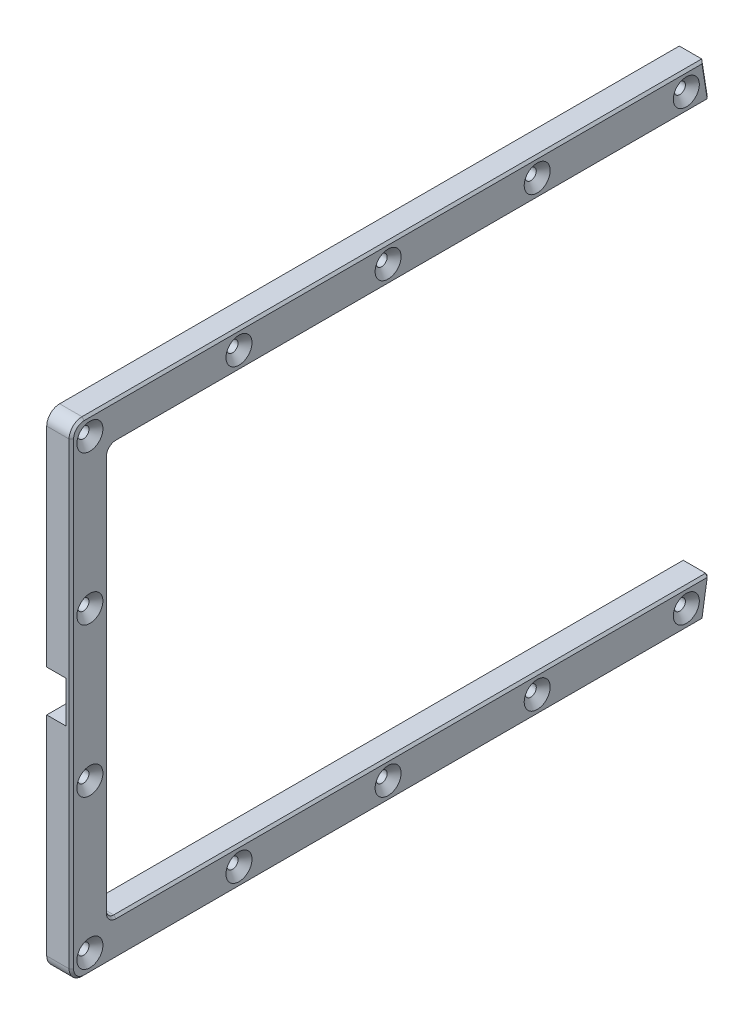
SolidWorks part; units mm, degrees
ref_plane "Front Plane" through (0, 0, 0) normal (0, 0, 1) x (1, 0, 0)
ref_plane "Top Plane" through (0, 0, 0) normal (0, 1, 0) x (1, 0, 0)
ref_plane "Right Plane" through (0, 0, 0) normal (1, 0, 0) x (0, 0, -1)
sketch "Sketch1" plane through (0, 0, 0) normal (1, 0, 0) x (0, 0, -1)
  line L0 (-5.4557, 104.0696) -> (-5.4557, -52.242)
  line L1 (-1.0615, -56.6362) -> (210.0633, -56.6362)
  line L2 (210.0633, -56.6362) -> (212.0757, -43.9362)
  line L3 (212.0757, -43.9362) -> (7.2189, -43.9362)
  line L4 (7.2189, -43.9362) -> (7.2189, 95.7638)
  line L5 (210.0633, 108.4638) -> (-1.0615, 108.4638)
  line L6 (0.8689, 0.5138) -> (7.2189, 0.5138) construction
  line L7 (210.0633, -56.6362) -> (223.1443, 25.9138) construction
  line L8 (210.0633, 108.4638) -> (-1.0615, 108.4638) construction
  line L9 (-1.0615, -56.6362) -> (210.0633, -56.6362) construction
  line L10 (7.2189, 95.7638) -> (212.0757, 95.7638)
  line L11 (7.2189, 95.7638) -> (7.2189, 108.4638) construction
  line L12 (212.0757, 95.7638) -> (210.0633, 108.4638)
  line L13 (223.1443, 25.9138) -> (210.0633, 108.4638) construction
  line L14 (102.4689, -50.2862) -> (102.4689, -43.9362) construction
  line L15 (51.6689, -43.9362) -> (51.6689, -56.6362) construction
  circle A0 centre (102.4689, -50.2862) radius 1.8923
  arc A1 (-5.4557, -52.242) -> (-1.0615, -56.6362) centre (-1.0615, -52.242) ccw construction
  circle A2 centre (0.8689, 51.3138) radius 1.8923 construction
  arc A3 (-5.4557, 104.0696) -> (-1.0615, 108.4638) centre (-1.0615, 104.0696) cw
  arc A4 (-1.0615, 108.4638) -> (-5.4557, 104.0696) centre (-1.0615, 104.0696) ccw construction
  circle A5 centre (204.0689, -50.2862) radius 1.8923 construction
  arc A6 (-5.4557, -52.242) -> (-1.0615, -56.6362) centre (-1.0615, -52.242) ccw
  circle A7 centre (153.2689, -50.2862) radius 1.8923 construction
  circle A8 centre (102.4689, -50.2862) radius 1.8923 construction
  circle A9 centre (153.2689, -50.2862) radius 1.8923
  circle A10 centre (51.6689, -50.2862) radius 1.8923
  circle A11 centre (0.8689, -50.2862) radius 1.8923
  circle A12 centre (0.8689, 0.5138) radius 1.8923
  circle A13 centre (0.8689, 51.3138) radius 1.8923
  circle A14 centre (204.0689, -50.2862) radius 1.8923
  circle A15 centre (51.6689, -50.2862) radius 1.8923 construction
  circle A16 centre (0.8689, -50.2862) radius 1.8923 construction
  circle A17 centre (0.8689, 0.5138) radius 1.8923 construction
  circle A18 centre (0.8689, 102.1138) radius 1.8923
  circle A19 centre (51.6689, 102.1138) radius 1.8923
  circle A20 centre (102.4689, 102.1138) radius 1.8923
  circle A21 centre (153.2689, 102.1138) radius 1.8923
  circle A22 centre (204.0689, 102.1138) radius 1.8923
  circle A23 centre (0.8689, 102.1138) radius 1.8923 construction
  circle A24 centre (51.6689, 102.1138) radius 1.8923 construction
  circle A25 centre (102.4689, 102.1138) radius 1.8923 construction
  circle A26 centre (153.2689, 102.1138) radius 1.8923 construction
  circle A27 centre (204.0689, 102.1138) radius 1.8923 construction
  point P8 (51.6689, -50.2862)
  point P43 (-1.0615, -52.242)
extrude "Boss-Extrude1" add sketch "Sketch1" along normal blind 8.382
chamfer "Chamfer1" distance 2.54 angle 41
fillet "Fillet1" radius 2.54
sketch "Sketch4" plane through (0, 0, 5.4557) normal (0, 0, 1) x (1, 0, 0)
  line L0 (0, 104.0696) -> (0, 30.4287) construction
  line L1 (0, 32.9687) -> (6.5024, 32.9687)
  line L2 (0, 32.9687) -> (0, 18.859)
  line L3 (0, 18.859) -> (6.5024, 18.859)
  line L4 (6.5024, 32.9687) -> (6.5024, 18.859)
  line L6 (4.7244, 30.4287) -> (-3.2639, 30.4287) construction
  line L7 (-3.2639, 21.399) -> (4.7244, 21.399) construction
  line L8 (4.7244, 21.399) -> (4.7244, 30.4287) construction
  dimension "D1" = 2.54
  dimension "D2" = 2.54
  dimension "D3" = 1.778
extrude "Cut-Extrude1" cut sketch "Sketch4" against normal offset from surface (10.1046 mm away) 2.57
chamfer "Chamfer2" distance 0.762 angle 45
